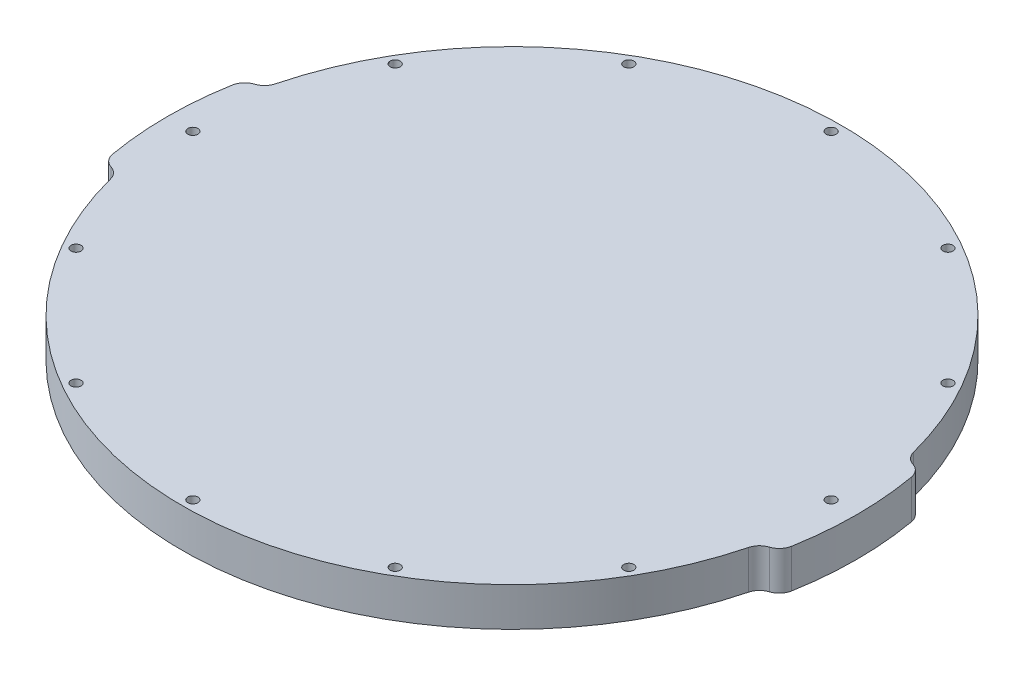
SolidWorks part; units mm, degrees
ref_plane "Front Plane" through (0, 0, 0) normal (0, 0, 1) x (1, 0, 0)
ref_plane "Top Plane" through (0, 0, 0) normal (0, 1, 0) x (1, 0, 0)
ref_plane "Right Plane" through (0, 0, 0) normal (1, 0, 0) x (0, 0, -1)
sketch "Sketch1" plane through (0, 0, 0) normal (0, 1, 0) x (1, 0, 0)
  line L0 (0, 0) -> (-111.234, 19.6136) construction
  line L1 (0, 0) -> (-139.7786, 0) construction
  line L2 (0, 0) -> (-111.234, -19.6136) construction
  line L3 (0, 0) -> (111.234, 19.6136) construction
  line L4 (0, 0) -> (111.234, -19.6136) construction
  circle A0 centre (0, 0) radius 104.55 construction
  circle A1 centre (0, 104.55) radius 1.65
  circle A2 centre (52.275, 90.543) radius 1.65
  circle A3 centre (90.543, 52.275) radius 1.65
  circle A4 centre (104.55, 0) radius 1.65
  circle A5 centre (90.543, -52.275) radius 1.65
  circle A6 centre (52.275, -90.543) radius 1.65
  circle A7 centre (0, -104.55) radius 1.65
  circle A8 centre (-52.275, -90.543) radius 1.65
  circle A9 centre (-90.543, -52.275) radius 1.65
  circle A10 centre (-104.55, 0) radius 1.65
  circle A11 centre (-90.543, 52.275) radius 1.65
  circle A12 centre (-52.275, 90.543) radius 1.65
  circle A13 centre (0, 0) radius 107.95 construction
  circle A14 centre (0, 0) radius 112.95 construction
  arc A15 (-111.234, -19.6136) -> (-111.234, 19.6136) centre (0, 0) cw
  arc A16 (111.234, -19.6136) -> (111.234, 19.6136) centre (0, 0) ccw
  arc A17 (-111.234, -19.6136) -> (-105.328, -23.6479) centre (-106.31, -18.7453) ccw
  arc A18 (-111.234, 19.6136) -> (-105.328, 23.6479) centre (-106.31, 18.7453) cw
  arc A19 (111.234, -19.6136) -> (105.328, -23.6479) centre (106.31, -18.7453) cw
  arc A20 (111.234, 19.6136) -> (105.328, 23.6479) centre (106.31, 18.7453) ccw
  arc A21 (-105.328, 23.6479) -> (105.328, 23.6479) centre (0, 0) cw
  arc A22 (105.328, -23.6479) -> (-105.328, -23.6479) centre (0, 0) cw
  point P30 (0, 0)
  dimension "D1" = 3.3
  dimension "D2" = 209.1
  dimension "D4" = 215.9
  dimension "D5" = 5
  dimension "D6" = 10
  dimension "D3" = 12
extrude "Boss-Extrude1" add sketch "Sketch1" along normal blind 12.7
fillet "Fillet1" radius 5 4 edges at (105.328, 6.35, 23.6479) (105.328, 6.35, -23.6479) (-105.328, 6.35, -23.6479) (-105.328, 6.35, 23.6479)
